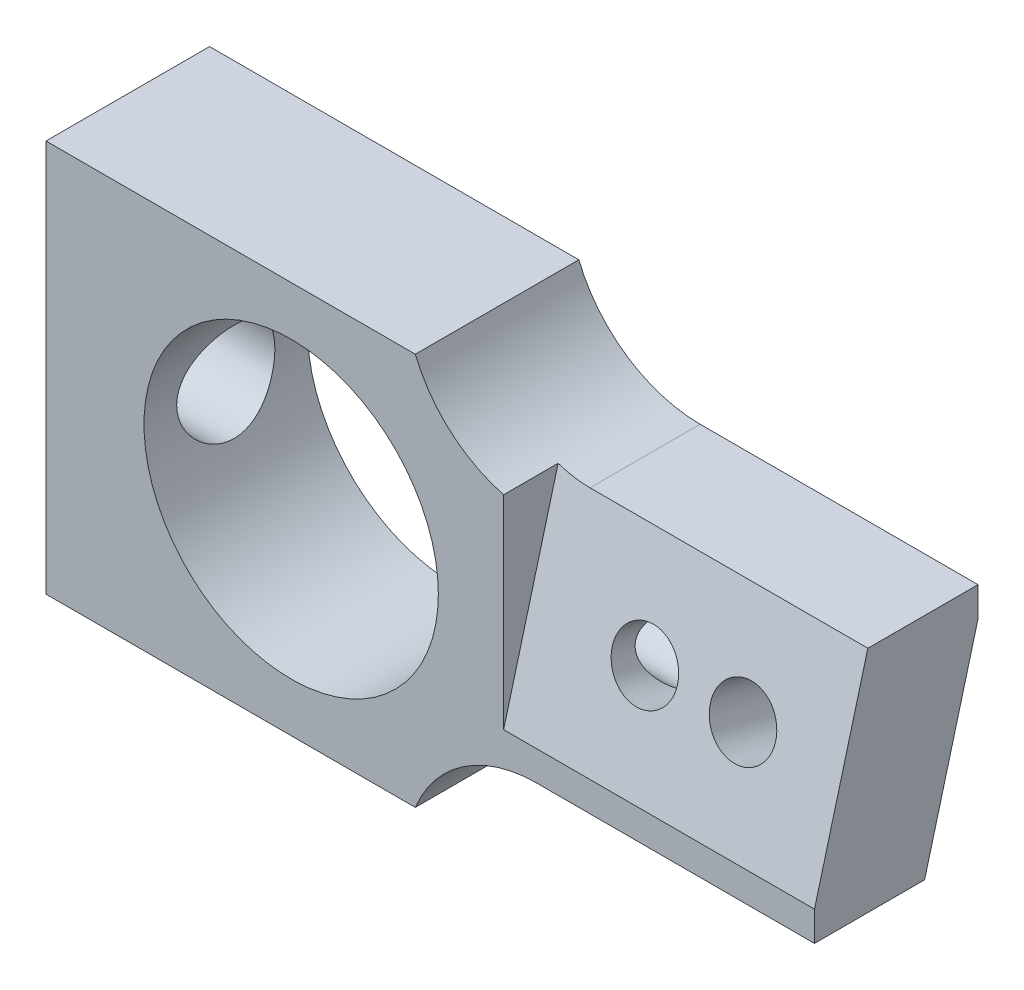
SolidWorks part; units mm, degrees
ref_plane "Front Plane" through (0, 0, 0) normal (0, 0, 1) x (1, 0, 0)
ref_plane "Top Plane" through (0, 0, 0) normal (0, 1, 0) x (1, 0, 0)
ref_plane "Right Plane" through (0, 0, 0) normal (1, 0, 0) x (0, 0, -1)
sketch "Sketch1" plane through (0, 0, 0) normal (0, 0, 1) x (1, 0, 0)
  line L0 (-23.7998, -19.05) -> (50.8, -19.05)
  line L1 (50.8, -19.05) -> (50.8, 19.05)
  line L2 (50.8, 19.05) -> (-23.7998, 19.05)
  line L3 (-23.7998, 19.05) -> (-23.7998, -19.05)
  line L4 (0, 0) -> (14.2875, 0) construction
  line L5 (50.8, -11.1125) -> (23.8252, -11.1125)
  line L6 (50.8, 11.1125) -> (23.8252, 11.1125)
  circle A0 centre (0, 0) radius 14.2875
  circle A2 centre (31.75, 0) radius 3.175
  circle A3 centre (41.275, 0) radius 3.175
  arc A4 (23.8252, 11.1125) -> (12.052, 19.05) centre (23.8252, 23.8125) cw
  arc A8 (23.8252, -11.1125) -> (12.052, -19.05) centre (23.8252, -23.8125) ccw
  dimension "D1" = 28.575
  dimension "D5" = 6.35
  dimension "D11" = 26.9748
  dimension "D8" = 12.7
  dimension "D2" = 38.1
  dimension "D3" = 23.7998
  dimension "D4" = 50.8
  dimension "D6" = 31.75
  dimension "D7" = 9.525
  dimension "D9" = 22.225
  dimension "D10" = 7.9375
sketch "Sketch2" plane through (0, 0, 0) normal (0, 0, 1) x (1, 0, 0)
  line L4 (-23.7998, 19.05) -> (-23.7998, -19.05) construction
  line L6 (-23.7998, -19.05) -> (50.8, -19.05) construction
  line L7 (50.8, 19.05) -> (-23.7998, 19.05) construction
  line L8 (50.8, -19.05) -> (50.8, 19.05) construction
  line L9 (-23.7998, -19.05) -> (12.052, -19.05)
  line L10 (-23.7998, 19.05) -> (-23.7998, -19.05)
  line L11 (12.052, 19.05) -> (-23.7998, 19.05)
  line L12 (50.8, -11.1125) -> (50.8, 11.1125)
  line L13 (50.8, 11.1125) -> (23.8252, 11.1125) construction
  line L14 (50.8, -11.1125) -> (23.8252, -11.1125) construction
  line L15 (50.8, 11.1125) -> (23.8252, 11.1125)
  line L16 (50.8, -11.1125) -> (23.8252, -11.1125)
  circle A0 centre (0, 0) radius 14.2875 construction
  arc A1 (12.052, 19.05) -> (23.8252, 11.1125) centre (23.8252, 23.8125) ccw construction
  arc A2 (23.8252, -11.1125) -> (12.052, -19.05) centre (23.8252, -23.8125) ccw construction
  arc A3 (12.052, 19.05) -> (23.8252, 11.1125) centre (23.8252, 23.8125) ccw
  circle A4 centre (0, 0) radius 14.2875
  arc A5 (23.8252, -11.1125) -> (12.052, -19.05) centre (23.8252, -23.8125) ccw
extrude "Boss-Extrude1" add sketch "Sketch2" along normal mid plane 15.875
sketch "Sketch3" plane through (0, 0, 0) normal (1, 0, 0) x (0, 0, -1)
  circle A0 centre (0, 0) radius 3.175
  circle A1 centre (0, 0) radius 4.7625
  dimension "D1" = 9.525
  dimension "D2" = 6.35
sketch "Sketch4" plane through (0, 0, 0) normal (1, 0, 0) x (0, 0, -1)
  circle A0 centre (0, 0) radius 4.7625 construction
  circle A1 centre (0, 0) radius 4.7625
extrude "Cut-Extrude1" cut sketch "Sketch4" against normal blind 50.8
sketch "Sketch5" plane through (0, 0, 0) normal (1, 0, 0) x (0, 0, -1)
  circle A0 centre (0, 0) radius 3.175 construction
  circle A1 centre (0, 0) radius 3.175
extrude "Cut-Extrude2" cut sketch "Sketch5" along normal blind 31.75
sketch "Sketch6" plane through (0, 0, 0) normal (0, 1, 0) x (1, 0, 0)
  line L0 (31.75, 0) -> (31.75, 11.43)
  line L1 (31.75, 11.43) -> (31.75, 17.78)
  circle A0 centre (31.75, 11.43) radius 6.35
  dimension "D2" = 12.7
  dimension "D1" = 11.43
sketch "Sketch7" plane through (0, 0, 0) normal (1, 0, 0) x (0, 0, -1)
  line L0 (9.8128, 15.2278) -> (0.2878, -20.32)
  line L1 (0.2878, -20.32) -> (9.8128, -20.32)
  line L2 (9.8128, -20.32) -> (9.8128, 15.2278)
  line L3 (-9.8128, -15.2278) -> (-0.2878, 20.32)
  line L4 (-0.2878, 20.32) -> (-9.8128, 20.32)
  line L5 (-9.8128, 20.32) -> (-9.8128, -15.2278)
  dimension "D1" = 20.32
  dimension "D2" = 5.5372
  dimension "D3" = 75
  dimension "D4" = 9.525
  dimension "D5" = 5.5372
  dimension "D6" = 9.525
  dimension "D7" = 20.32
extrude "Cut-Extrude3" cut sketch "Sketch7" along normal blind 43.18 from offset 20.6248
sketch "Sketch8" plane through (0, -1.4331, -5.3485) normal (0, -0.2588, -0.9659) x (-1, 0, 0)
  circle A0 centre (-31.75, 0) radius 3.175
  circle A1 centre (-41.275, 0) radius 3.175
  dimension "D2" = 6.35
  dimension "D1" = 31.75
  dimension "D3" = 9.525
extrude "Cut-Extrude4" cut sketch "Sketch8" against normal blind 25.4
